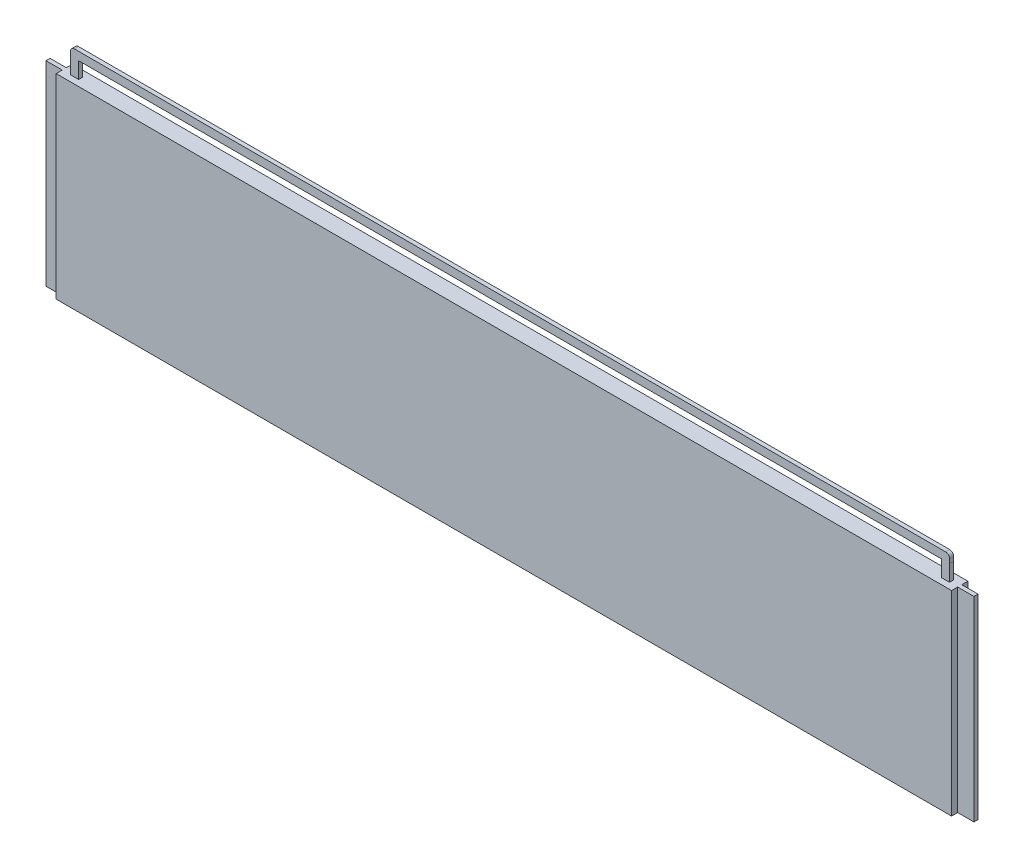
SolidWorks part; units mm, degrees
ref_plane "Front Plane" through (0, 0, 0) normal (0, 0, 1) x (1, 0, 0)
ref_plane "Top Plane" through (0, 0, 0) normal (0, 1, 0) x (1, 0, 0)
ref_plane "Right Plane" through (0, 0, 0) normal (1, 0, 0) x (0, 0, -1)
sketch "Sketch2" plane through (0, 0, 0) normal (0, 1, 0) x (1, 0, 0)
  line L0 (55.4279, -3.175) -> (80.8279, -3.175) construction
  line L1 (-1341.5721, 9.525) -> (55.4279, 9.525)
  line L2 (-1341.5721, 9.525) -> (-1341.5721, 0)
  line L3 (-1341.5721, -15.875) -> (55.4279, -15.875)
  line L4 (55.4279, 9.525) -> (55.4279, 0)
  line L5 (-1341.5721, 9.525) -> (55.4279, -15.875) construction
  line L6 (-1341.5721, -15.875) -> (55.4279, 9.525) construction
  line L7 (80.8279, -3.175) -> (80.8279, 0)
  line L8 (80.8279, -3.175) -> (80.8279, -6.35)
  line L9 (80.8279, -6.35) -> (55.4279, -6.35)
  line L10 (80.8279, 0) -> (55.4279, 0)
  line L11 (-1341.5721, -3.175) -> (-1366.9721, -3.175) construction
  line L12 (-1366.9721, -3.175) -> (-1366.9721, 0)
  line L13 (-1366.9721, 0) -> (-1341.5721, 0)
  line L14 (-1366.9721, -3.175) -> (-1366.9721, -6.35)
  line L15 (-1366.9721, -6.35) -> (-1341.5721, -6.35)
  line L16 (-1341.5721, -6.35) -> (-1341.5721, -15.875)
  line L17 (55.4279, -6.35) -> (55.4279, -15.875)
  point P0 (-643.0721, -3.175)
extrude "Boss-Extrude2" add sketch "Sketch2" along normal blind 304.8
ref_plane "Plane1" through (0, 304.8, 0) normal (0, 1, 0) x (-1, 0, 0)
sketch "Sketch3" plane through (0, 304.8, 0) normal (0, 1, 0) x (-1, 0, 0)
  line L0 (1341.5721, 6.35) -> (1328.8721, 6.35) construction
  line L1 (1328.8721, 6.35) -> (1328.8721, 0)
  line L2 (1328.8721, 0) -> (1316.0702, 0)
  line L3 (1316.0702, 0) -> (1316.0702, 6.35)
  line L4 (1316.0702, 6.35) -> (1328.8721, 6.35)
  line L5 (-55.4279, 6.35) -> (-42.7279, 6.35) construction
  line L6 (-42.7279, 6.35) -> (-42.7279, 0)
  line L7 (-42.7279, 0) -> (-30.0279, 0)
  line L8 (-30.0279, 0) -> (-30.0279, 6.35)
  line L9 (-30.0279, 6.35) -> (-42.7279, 6.35)
extrude "Boss-Extrude3" add sketch "Sketch3" along normal blind 25.4
ref_plane "Plane2" through (0, 330.2, 0) normal (0, 1, 0) x (-1, 0, 0)
sketch "Sketch5" plane through (0, 330.2, 0) normal (0, 1, 0) x (-1, 0, 0)
  line L0 (1328.8721, 0) -> (1328.8721, 6.35)
  line L1 (1328.8721, 0) -> (-42.8873, 0)
  line L2 (1328.8721, 6.35) -> (-42.8873, 6.35)
  line L3 (-42.8873, 0) -> (-42.8873, 6.35)
extrude "Boss-Extrude4" add sketch "Sketch5" along normal blind 12.7
fillet "Fillet1" radius 6.35 2 edges at (-1328.8721, 342.9, 3.175) (42.8873, 342.9, 3.175)
